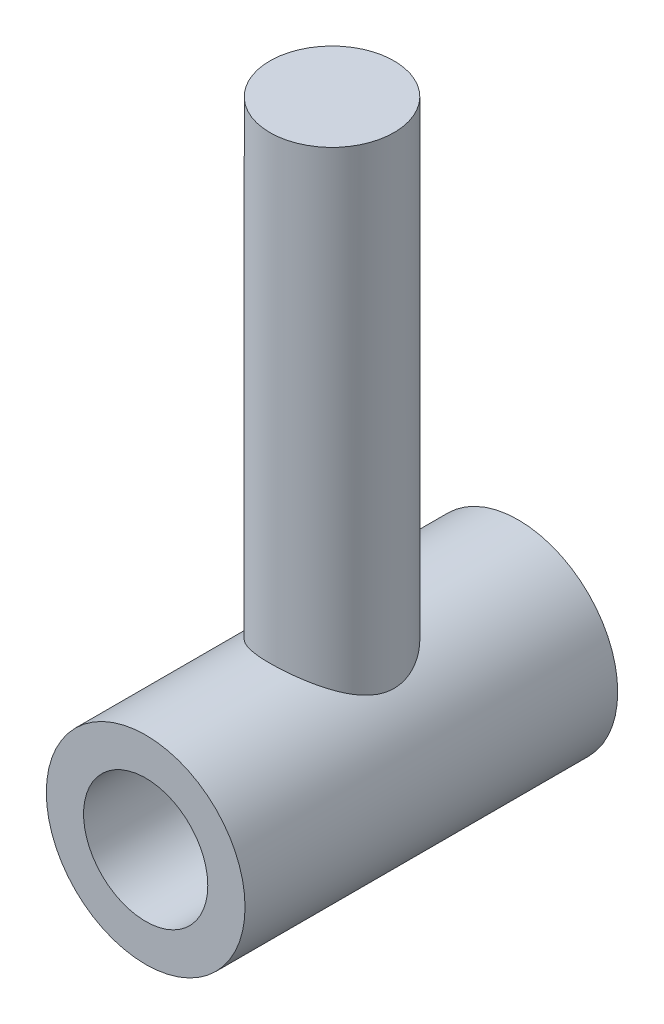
SolidWorks part; units mm, degrees
ref_plane "Front Plane" through (0, 0, 0) normal (0, 0, 1) x (1, 0, 0)
ref_plane "Top Plane" through (0, 0, 0) normal (0, 1, 0) x (1, 0, 0)
ref_plane "Right Plane" through (0, 0, 0) normal (1, 0, 0) x (0, 0, -1)
sketch "Sketch1" plane through (0, 0, 0) normal (0, 0, 1) x (1, 0, 0)
  circle A0 centre (0, 0) radius 5
  dimension "D1" = 10
extrude "Extrude-Thin1" add sketch "Sketch1" along normal mid plane 30 thin
sketch "Sketch2" plane through (0, 0, 0) normal (0, 1, 0) x (1, 0, 0)
  circle A0 centre (0, 0) radius 5
  dimension "D1" = 10
extrude "Boss-Extrude1" add sketch "Sketch2" against normal up to surface (37 mm away) from offset 45
